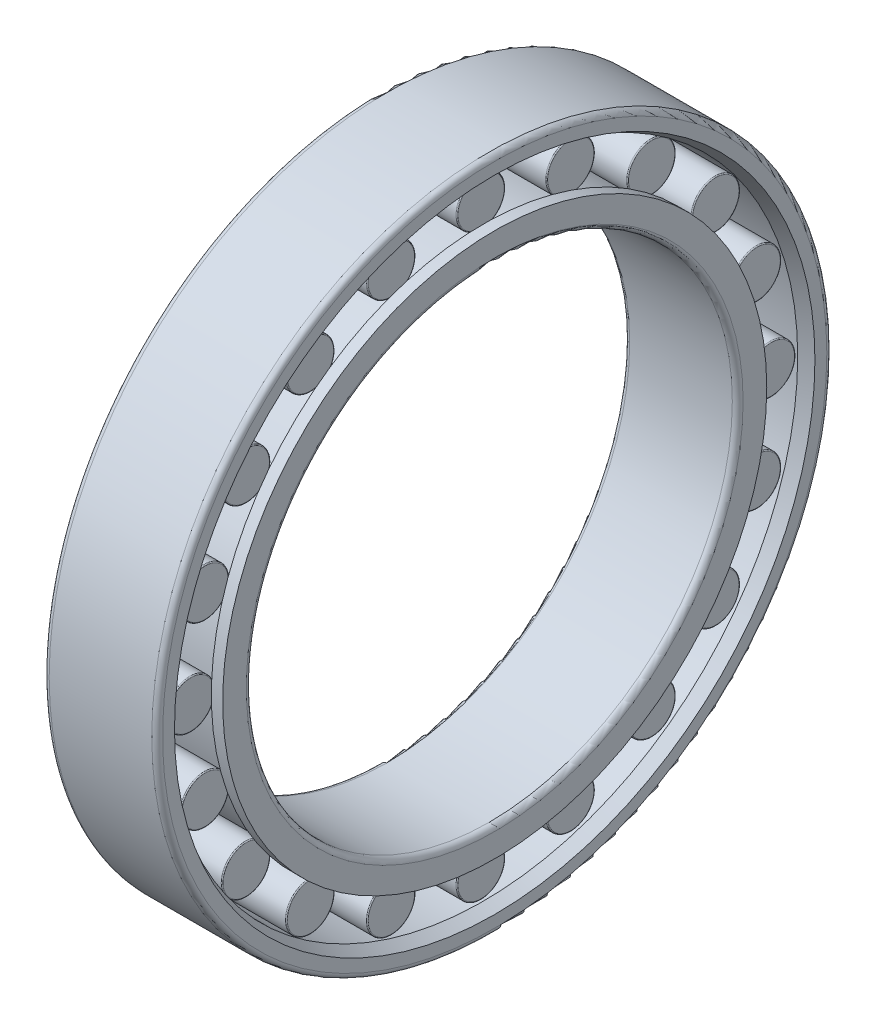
SolidWorks part; units mm, degrees
ref_plane "Plane1" through (0, 0, 0) normal (0, 0, 1) x (1, 0, 0)
ref_plane "Plane2" through (0, 0, 0) normal (0, 1, 0) x (1, 0, 0)
ref_plane "Plane3" through (0, 0, 0) normal (1, 0, 0) x (0, 0, -1)
sketch "Clipboard" plane through (0, 0, 0) normal (0, 0, 1) x (1, 0, 0)
  line L0 (-10, 0) -> (10, 0) construction
  line L1 (0, 0) -> (185.2698, -67.4327)
  line L2 (0, 0) -> (101.017, 36.7672)
  line L3 (0, 0) -> (218.798, -79.636)
  line L4 (0, 0) -> (-22.3471, -0.7804)
  dimension "CLdia" = 107.5
  dimension "Count" = 20
  dimension "Show_count" = 20
  dimension "Max_count" = 20
  dimension "Min_count" = 2
  dimension "Race_OD" = 232.84
  dimension "Race_ID" = 197.16
sketch "OutRacSke" plane through (0, 0, 0) normal (0, 0, 1) x (1, 0, 0)
  line L0 (16.8, 116.42) -> (21, 118.5944)
  line L1 (-21, 118.5944) -> (-21, 123)
  line L2 (-19, 125) -> (19, 125)
  line L3 (21, 123) -> (21, 118.5944)
  line L4 (-16.8, 116.42) -> (-21, 118.5944)
  line L6 (16.8, 116.42) -> (-16.8, 116.42)
  line L8 (-90, 0) -> (90, 0) construction
  arc A0 (-21, 123) -> (-19, 125) centre (-19, 123) cw
  arc A1 (19, 125) -> (21, 123) centre (19, 123) cw
  dimension "radius" = 2
  dimension "Race_OD" = 232.84
  dimension "OD" = 250
  dimension "Cyl_Len" = 33.6
  dimension "halfCylLen" = 16.8
  dimension "Width" = 42
  dimension "halfWidth" = 21
  dimension "groove_dp" = 2.1744
revolve "OuterRace" add sketch "OutRacSke" angle 360 about L8
sketch "RolDetSke" plane through (0, 0, 0) normal (0, 0, 1) x (1, 0, 0)
  line L0 (-15.96, 116.068) -> (-15.96, 107.5)
  line L1 (-15.96, 107.5) -> (15.96, 107.5)
  line L2 (15.96, 107.5) -> (15.96, 116.068)
  line L3 (15.603, 116.425) -> (-15.603, 116.425)
  line L4 (-33.6, 107.5) -> (33.6, 107.5) construction
  arc A0 (15.96, 116.068) -> (15.603, 116.425) centre (15.603, 116.068) ccw
  arc A1 (-15.603, 116.425) -> (-15.96, 116.068) centre (-15.603, 116.068) ccw
  dimension "radius" = 0.357
  dimension "RolCLRad" = 107.5
  dimension "Length" = 31.92
  dimension "halfLength" = 15.96
  dimension "Roller_diameter" = 17.85
revolve "RollerDetailed" add sketch "RolDetSke" angle 360 about L4
ref_axis "Axis1" through (-50, 0, 0) along (1, 0, 0)
sketch "RolSimSke" plane through (0, 101.6, 0) normal (0, 0, 1) x (1, 0, 0)
  line L0 (-15.96, 14.468) -> (-15.96, -2.668)
  line L1 (25.4, -101.6) -> (-25.4, -101.6) construction
  line L2 (15.96, -2.668) -> (15.96, 14.468)
  line L3 (15.603, 14.825) -> (-15.603, 14.825)
  line L5 (15.603, -3.025) -> (-15.603, -3.025)
  arc A0 (15.96, 14.468) -> (15.603, 14.825) centre (15.603, 14.468) ccw
  arc A1 (-15.603, 14.825) -> (-15.96, 14.468) centre (-15.603, 14.468) ccw
  arc A2 (15.96, -2.668) -> (15.603, -3.025) centre (15.603, -2.668) cw
  arc A3 (-15.603, -3.025) -> (-15.96, -2.668) centre (-15.603, -2.668) cw
  dimension "radius" = 0.357
  dimension "D1" = 98.575
  dimension "Roller_diameter" = 17.85
  dimension "Rol_Length" = 31.92
  dimension "halfLength" = 15.96
revolve "RollersSimplified" [suppressed] add sketch "RolSimSke" angle 360 about L1
sketch "InsRacSke" plane through (0, 0, 0) normal (0, 0, 1) x (1, 0, 0)
  line L0 (16.8, 98.58) -> (16.8, 100.7544)
  line L1 (-21, 100.7544) -> (-21, 92)
  line L2 (-19, 90) -> (19, 90)
  line L3 (21, 92) -> (21, 100.7544)
  line L4 (16.8, 100.7544) -> (21, 100.7544)
  line L5 (16.8, 98.58) -> (-16.8, 98.58)
  line L6 (-90, 0) -> (90, 0) construction
  line L8 (-16.8, 98.58) -> (-16.8, 100.7544)
  line L9 (-16.8, 100.7544) -> (-21, 100.7544)
  arc A0 (-21, 92) -> (-19, 90) centre (-19, 92) ccw
  arc A1 (19, 90) -> (21, 92) centre (19, 92) ccw
  dimension "radius" = 2
  dimension "Bore" = 180
  dimension "Race_ID" = 197.16
  dimension "Width" = 42
  dimension "halfWidth" = 21
  dimension "groove_dp" = 2.1744
  dimension "Cyl_Len" = 33.6
  dimension "halfCylLen" = 16.8
revolve "InnerRace" add sketch "InsRacSke" angle 360 about L6
pattern_circular "RollersDetailed" count 20 every 18 about axis through (-50, 0, 0) along (1, 0, 0) of "RollerDetailed"
sketch "CagSpiSke" plane through (0, 0, 0) normal (0, 0, 1) x (1, 0, 0)
  line L0 (18.9, 105.2687) -> (18.9, 109.7313)
  line L1 (18.9, 109.7313) -> (-18.9, 109.7313)
  line L2 (-18.9, 109.7313) -> (-18.9, 105.2687)
  line L3 (-18.9, 105.2687) -> (18.9, 105.2687)
  line L4 (-90, 0) -> (90, 0) construction
  dimension "Cag_IR" = 210.5375
  dimension "thickness" = 4.4625
  dimension "width" = 37.8
  dimension "halfwidth" = 18.9
revolve "CageSpine" [suppressed] add sketch "CagSpiSke" angle 360 about L4
equation "\"CLdia@Clipboard\" =  ( \"Race_OD@Clipboard\" + \"Race_ID@Clipboard\" )  / 4"
equation "\"Race_OD@OutRacSke\" = \"Race_OD@Clipboard\""
equation "\"halfCylLen@OutRacSke\" = \"Cyl_Len@OutRacSke\" / 2"
equation "\"RolCLRad@RolDetSke\" = \"CLdia@Clipboard\""
equation "\"Roller_diameter@RolDetSke\" =  ( \"Race_OD@Clipboard\" - \"Race_ID@Clipboard\" )  / 2 + .01"
equation "\"Roller_diameter@RolSimSke\" =  ( \"Race_OD@Clipboard\" - \"Race_ID@Clipboard\" )  / 2 + .01"
equation "\"radius@RolDetSke\" = \"Roller_diameter@RolDetSke\" / 50"
equation "\"Length@RolDetSke\" = \"Cyl_Len@OutRacSke\" * .95"
equation "\"halfLength@RolDetSke\" = \"Length@RolDetSke\" / 2"
equation "\"thickness@CagSpiSke\"  = \"Roller_diameter@RolDetSke\" * .25"
equation "\"Cag_IR@CagSpiSke\" =  \"RolCLRad@RolDetSke\" * 2 - \"thickness@CagSpiSke\""
equation "\"Rol_length@RolSimSke\" = \"Cyl_Len@InsRacSke\" * .95"
equation "\"halfLength@RolSimSke\" = \"Rol_length@RolSimSke\" / 2"
equation "\"radius@RolSimSke\" = \"radius@RolDetSke\""
equation "\"D1@RolSimSke\" = \"CLdia@Clipboard\" -  ( \"Roller_diameter@RolSimSke\" / 2 ) "
equation "\"Max_count@Clipboard\" = int( 3.14159265 / atn(( \"Roller_diameter@RolDetSke\" / 2) / sqr( \"RolCLRad@RolDetSke\"  *  \"RolCLRad@RolDetSke\" - ( \"Roller_diameter@RolDetSke\" / 2) *  ( \"Roller_diameter@RolDetS"
equation "\"Max_count@Clipboard\" = ((sgn( \"Max_count@Clipboard\" - \"Count@Clipboard\" )-1)*( \"Max_count@Clipboard\" - \"Count@Clipboard\" ))/-2+ \"Count@Clipboard\""
equation "\"Count@RollersDetailed\" = int( \"Show_count@Clipboard\" ) "
equation "\"Count@RollersDetailed\" = ((sgn( \"Count@RollersDetailed\" - \"Max_count@Clipboard\" )-1)*( \"Count@RollersDetailed\" - \"Max_count@Clipboard\" ))/-2+ \"Max_count@Clipboard\""
equation "\"Count@RollersDetailed\" = ((sgn( \"Count@RollersDetailed\" - \"Min_count@Clipboard\" )+1)*( \"Count@RollersDetailed\" - \"Min_count@Clipboard\"))/2 +\"Min_count@Clipboard\""
equation "\"Angle@RollersDetailed\" = 360.0 / \"Max_count@Clipboard\""
equation "\"radius@InsRacSke\" = \"radius@OutRacSke\""
equation "\"groove_dp@InsRacSke\" = \"groove_dp@OutRacSke\""
equation "\"Width@InsRacSke\" = \"Width@OutRacSke\""
equation "\"halfWidth@OutRacSke\" = \"Width@OutRacSke\" / 2"
equation "\"halfWidth@InsRacSke\" = \"Width@InsRacSke\" / 2"
equation "\"Race_ID@InsRacSke\" = \"Race_ID@Clipboard\""
equation "\"Cyl_Len@InsRacSke\" = \"Cyl_Len@OutRacSke\""
equation "\"halfCylLen@InsRacSke\" = \"Cyl_Len@InsRacSke\" / 2"
equation "\"Angle@CageSpine\" =  \"Angle@RollersDetailed\" * ( \"Count@RollersDetailed\" -1 + int( \"Count@RollersDetailed\" / \"Max_count@Clipboard\" ) )  + 0.001 -  int( \"Count@RollersDetailed\" / \"Max_count@Clipboard\" "
equation "\"Angle@CageSpine\" =  \"Angle@CageSpine\" * int( \"Min_count@Clipboard\" / 2) + int(1 / \"Min_count@Clipboard\")  * 0.001"
equation "\"width@CagSpiSke\" =   ( \"Width@InsRacSke\" + \"Cyl_Len@InsRacSke\" )  / 2"
equation "\"halfwidth@CagSpiSke\" = \"width@CagSpiSke\" / 2"
